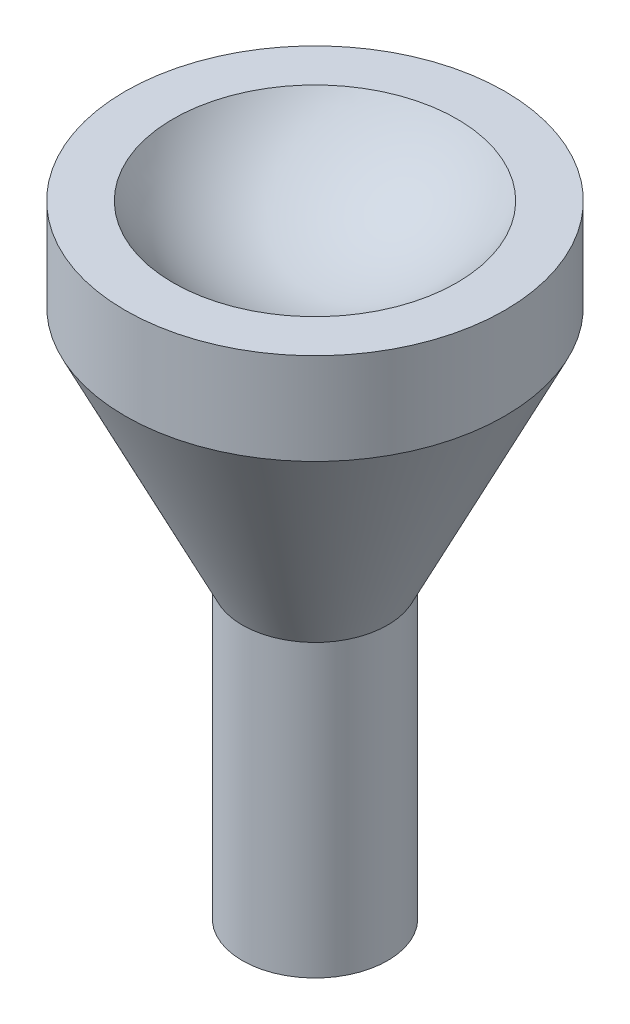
SolidWorks part; units mm, degrees
ref_plane "Front Plane" through (0, 0, 0) normal (0, 0, 1) x (1, 0, 0)
ref_plane "Top Plane" through (0, 0, 0) normal (0, 1, 0) x (1, 0, 0)
ref_plane "Right Plane" through (0, 0, 0) normal (1, 0, 0) x (0, 0, -1)
sketch "Sketch1" plane through (0, 0, 0) normal (0, 0, 1) x (1, 0, 0)
  line L0 (0, 0) -> (2.5, 0)
  line L1 (2.5, 0) -> (2.5, 10)
  line L2 (2.5, 10) -> (6.5298, 18.2431)
  line L3 (6.5298, 18.2431) -> (6.5298, 21.3945)
  line L4 (6.5298, 21.3945) -> (4.8836, 21.3945)
  line L5 (0, 18.6902) -> (0, 24.4519) construction
  line L6 (0, 18.6902) -> (0, 0)
  arc A0 (0, 18.6902) -> (4.8836, 21.3945) centre (0, 24.4519) ccw
  dimension "D1" = 2.5
  dimension "D7" = 10
revolve "Revolve1" add sketch "Sketch1" angle 360 about L6
